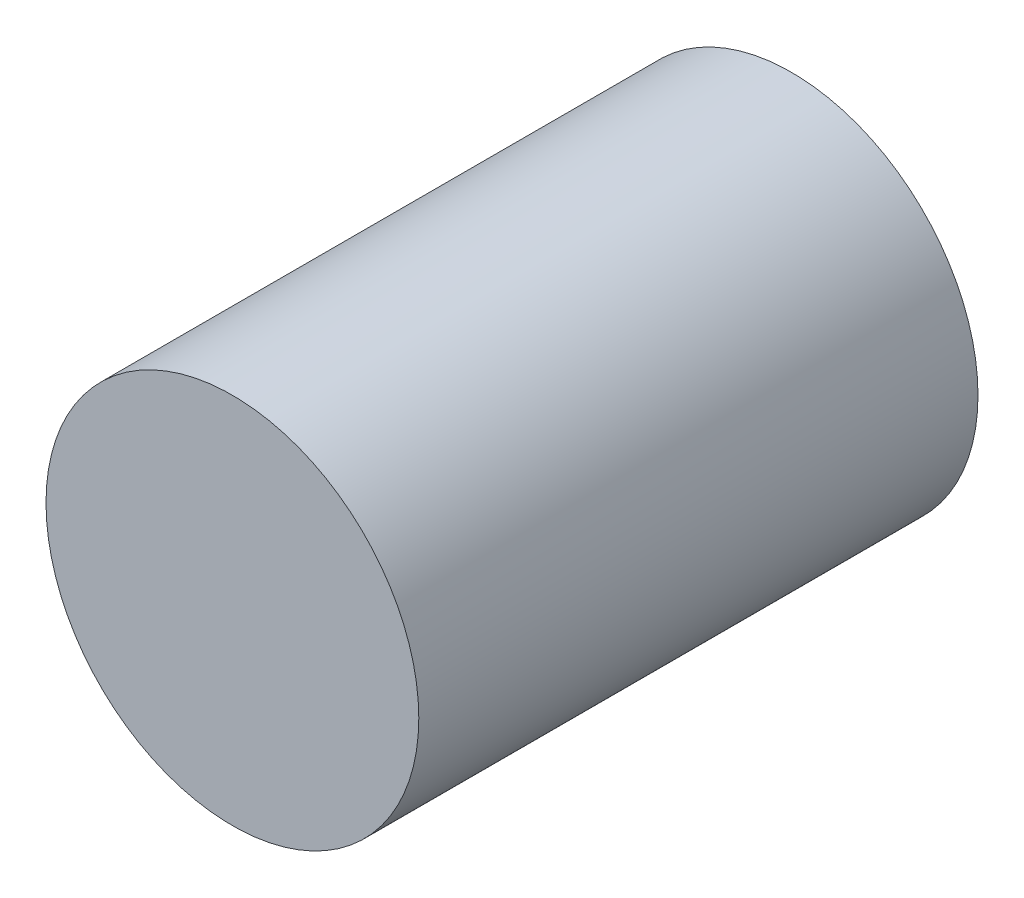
SolidWorks part; units mm, degrees
ref_plane "Ebene vorne" through (0, 0, 0) normal (0, 0, 1) x (1, 0, 0)
ref_plane "Ebene oben" through (0, 0, 0) normal (0, 1, 0) x (1, 0, 0)
ref_plane "Ebene rechts" through (0, 0, 0) normal (1, 0, 0) x (0, 0, -1)
sketch "Skizze1" plane through (0, 0, 0) normal (0, 0, 1) x (1, 0, 0)
  circle A0 centre (0, 0) radius 10
  dimension "D1" = 20
extrude "Aufsatz-Linear austragen1" add sketch "Skizze1" along normal blind 30
